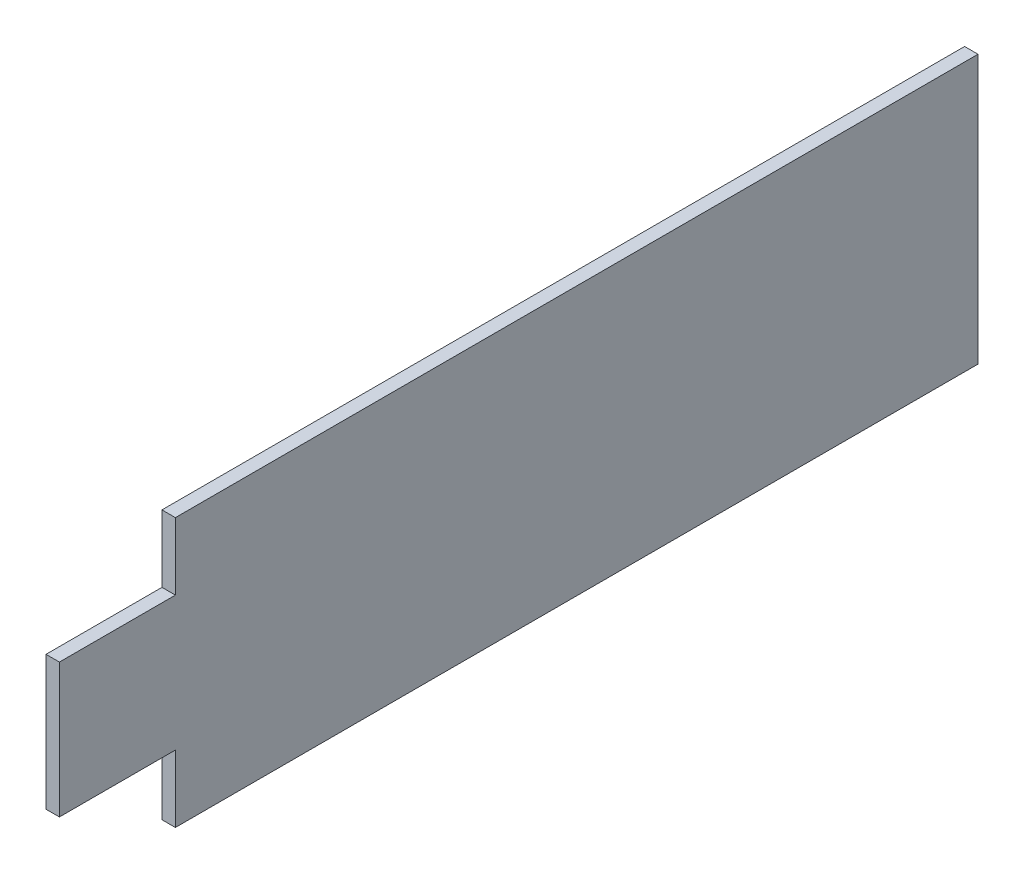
SolidWorks part; units mm, degrees
ref_plane "Front Plane" through (0, 0, 0) normal (0, 0, 1) x (1, 0, 0)
ref_plane "Top Plane" through (0, 0, 0) normal (0, 1, 0) x (1, 0, 0)
ref_plane "Right Plane" through (0, 0, 0) normal (1, 0, 0) x (0, 0, -1)
sketch "Sketch1" plane through (0, 0, 0) normal (1, 0, 0) x (0, 0, -1)
  line L0 (147.2842, 20) -> (147.2842, -20)
  line L5 (17.2842, -20) -> (147.2842, -20)
  line L6 (17.2842, -10) -> (17.2842, -20)
  line L7 (0, -10) -> (17.2842, -10)
  line L8 (0, 10) -> (0, -10)
  line L9 (17.2842, 10) -> (0, 10)
  line L10 (17.2842, 20) -> (17.2842, 10)
  line L12 (17.2842, 20) -> (147.2842, 20)
  point P0 (0, 0)
  point P22 (96.319, -0.1786)
  dimension "D5" = 130
  dimension "D1" = 40
  dimension "D2" = 20
  dimension "D3" = 10
  dimension "D4" = 17.2842
extrude "Boss-Extrude1" add sketch "Sketch1" along normal mid plane 2
sketch "Sketch2" plane through (0, 20, 0) normal (0, 1, 0) x (1, 0, 0)
  line L0 (1, 147.2842) -> (1, 17.2842) construction
  line L1 (-1, 147.2842) -> (-1, 17.2842) construction
  line L2 (1, 197.2138) -> (1, 136.9118)
  line L3 (-1, 197.2138) -> (-1, 136.9118)
  line L4 (-1, 197.2138) -> (1, 197.2138)
  line L5 (0, 17.2842) -> (0, 136.9142) construction
  line L6 (1, 17.2842) -> (-1, 17.2842) construction
  arc A1 (1, 136.9118) -> (-1, 136.9118) centre (0, -76.1927) ccw
  circle A4 centre (0, -57.7158) radius 219.1973
  circle A5 centre (0, -57.7158) radius 219.1973
  dimension "D2" = 119.63
  dimension "D1" = 0
extrude "Cut-Extrude1" cut sketch "Sketch2" against normal through all contours L2 A1 L3 L4
